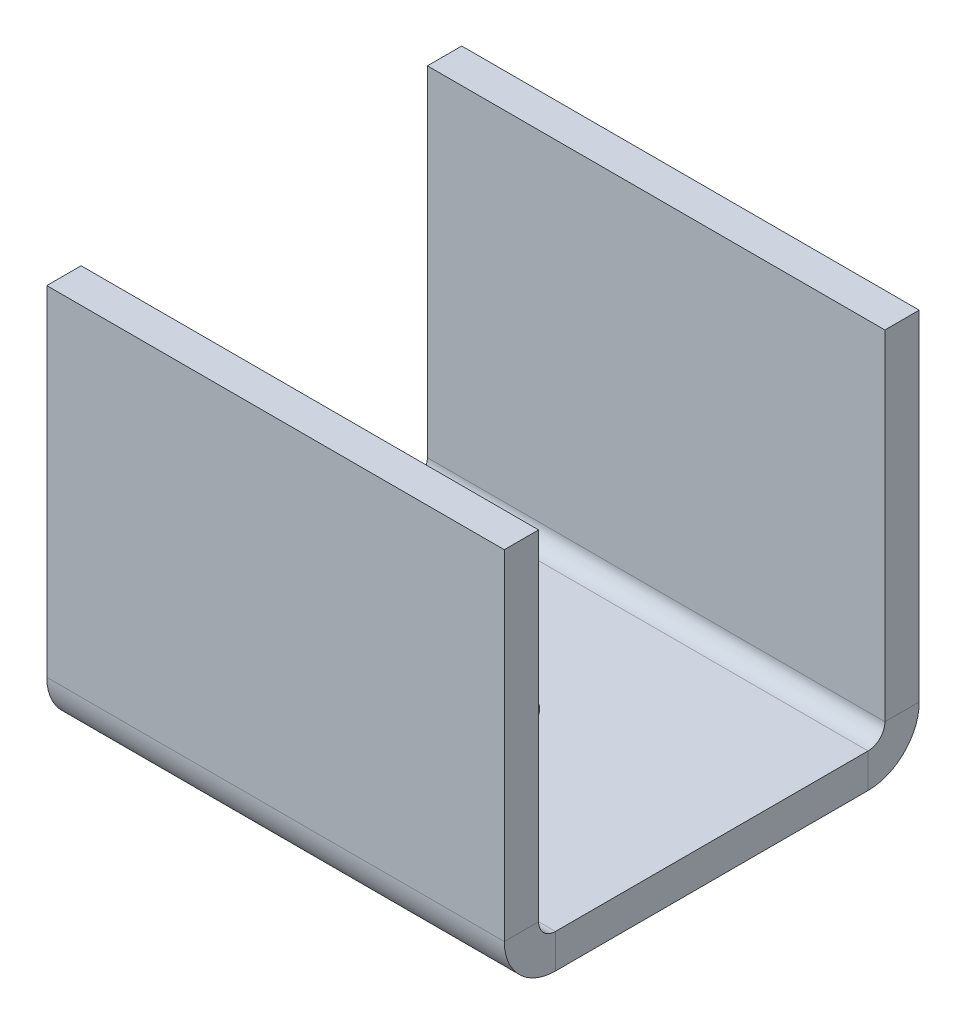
SolidWorks part; units mm, degrees
ref_plane "Front Plane" through (0, 0, 0) normal (0, 0, 1) x (1, 0, 0)
ref_plane "Top Plane" through (0, 0, 0) normal (0, 1, 0) x (1, 0, 0)
ref_plane "Right Plane" through (0, 0, 0) normal (1, 0, 0) x (0, 0, -1)
sketch "Sketch1" plane through (0, 0, 0) normal (0, 1, 0) x (1, 0, 0)
  line L0 (0, 48) -> (20, 0) construction
  line L1 (0, 0) -> (20, 0)
  line L2 (0, 0) -> (0, 48)
  line L3 (0, 48) -> (20, 48)
  line L4 (20, 0) -> (20, 48)
  circle A0 centre (10, 24) radius 1.75
  dimension "D1" = 20
  dimension "D2" = 48
sheet metal parameters "Sheet-Metal1" thickness 1.5 parameters "D1"=0.7366
base flange "Base-Flange1" sketch "Sketch1" thickness 1.5 reverse thickness direction yes parameters "D1"=0.7366
sketch "Sketch3" plane through (0, 1.5, 0) normal (0, 1, 0) x (-1, 0, 0)
  line L1 (0, -16) -> (-20, -16)
  line L2 (0, -32) -> (-20, -32)
sketched bend "Sketched Bend1" parameters "D1"=0.7366
bend "SketchBend1" bend radius 0.7366 bend angle 90 parameters "D5"=1
bend "SketchBend2" bend radius 0 bend angle 90 parameters "D5"=2
flat pattern "Flat-Pattern1"
sketch "Bend-Lines1" plane through (0, 0, 0) normal (0, 1, 0) x (-1, 0, 0)
bend of the flat pattern "Flatten-<SketchBend1>1"
bend of the flat pattern "Flatten-<SketchBend2>1"
